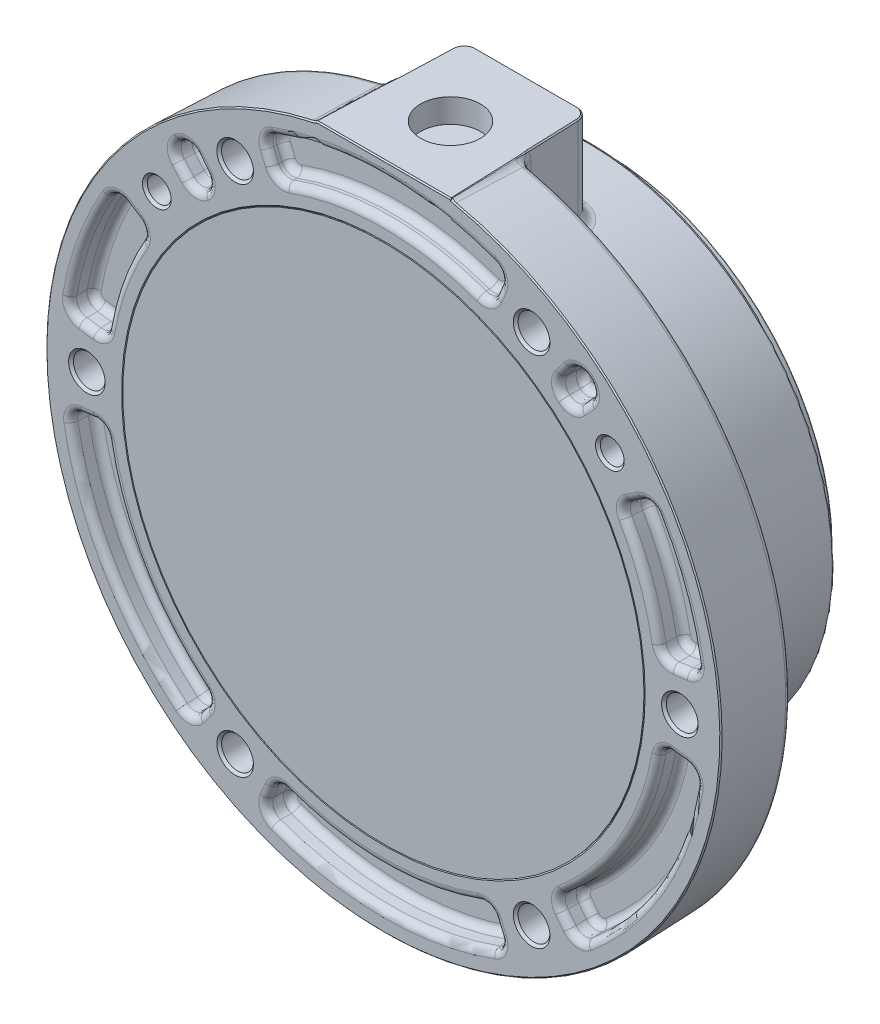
SolidWorks part; units mm, degrees
ref_plane "前视基准面" through (0, 0, 0) normal (0, 0, 1) x (1, 0, 0)
ref_plane "上视基准面" through (0, 0, 0) normal (0, 1, 0) x (1, 0, 0)
ref_plane "右视基准面" through (0, 0, 0) normal (1, 0, 0) x (0, 0, -1)
imported_body "45-底座-1-solid1"
imported_body "i25-底座元件板-1-solid1"
sketch "草图1" plane through (0, 0, 86) normal (0, 0, -1) x (-1, 0, 0)
  circle A0 centre (0, 0) radius 109 construction
  circle A1 centre (0, 0) radius 109
extrude "凸台-拉伸1" add sketch "草图1" along normal up to surface and the other way up to surface
sketch "草图2" plane through (0, 138.7985, 0) normal (0, 1, 0) x (1, 0, 0)
  line L0 (-19.5, -36) -> (19.5, -36) construction
  line L1 (-19.5, -36) -> (19.5, -36)
  line L2 (22, -38.5) -> (22, -77.5) construction
  line L3 (19.5, -80) -> (-19.5, -80) construction
  line L4 (-22, -77.5) -> (-22, -38.5) construction
  line L5 (22, -38.5) -> (22, -77.5)
  line L6 (19.5, -80) -> (-19.5, -80)
  line L7 (-22, -77.5) -> (-22, -38.5)
  arc A0 (-19.5, -36) -> (-22, -38.5) centre (-19.5, -38.5) ccw construction
  arc A1 (-19.5, -36) -> (-22, -38.5) centre (-19.5, -38.5) ccw
  arc A2 (22, -38.5) -> (19.5, -36) centre (19.5, -38.5) ccw construction
  arc A3 (19.5, -80) -> (22, -77.5) centre (19.5, -77.5) ccw construction
  arc A4 (-22, -77.5) -> (-19.5, -80) centre (-19.5, -77.5) ccw construction
  arc A5 (22, -38.5) -> (19.5, -36) centre (19.5, -38.5) ccw
  arc A6 (19.5, -80) -> (22, -77.5) centre (19.5, -77.5) ccw
  arc A7 (-22, -77.5) -> (-19.5, -80) centre (-19.5, -77.5) ccw
extrude "凸台-拉伸2" add sketch "草图2" against normal blind 68
sketch "草图3" plane through (0, 0, 62) normal (0, 0, -1) x (-1, 0, 0)
  line L3 (22, 70.7985) -> (-22, 70.7985)
  line L4 (-22, 70.7985) -> (-22, 91.0415)
  line L5 (22, 91.0415) -> (22, 70.7985)
  arc A0 (22, 91.0415) -> (-22, 91.0415) centre (0, 0) ccw
  arc A1 (-22, 91.0415) -> (22, 91.0415) centre (0, 0) ccw
  arc A2 (-22, 91.0415) -> (22, 91.0415) centre (0, 0) ccw
  dimension "D1" = 0
extrude "凸台-拉伸3" add sketch "草图3" along normal up to surface (59.5 mm away)
move or copy body "实体-移动/复制1" bodies to move or copy 246 copy no translate (0, 0, -92) parameters "D1"=0, "D2"=0, "D3"=92
sketch "草图4" plane through (0, 138.7985, 0) normal (0, 1, 0) x (1, 0, 0)
  line L0 (-140.2325, 28.0698) -> (140.2325, 28.0698) construction
  circle A0 centre (0, 28.0698) radius 12.5
  dimension "D1" = 25
extrude "切除-拉伸1" cut sketch "草图4" against normal blind 10
